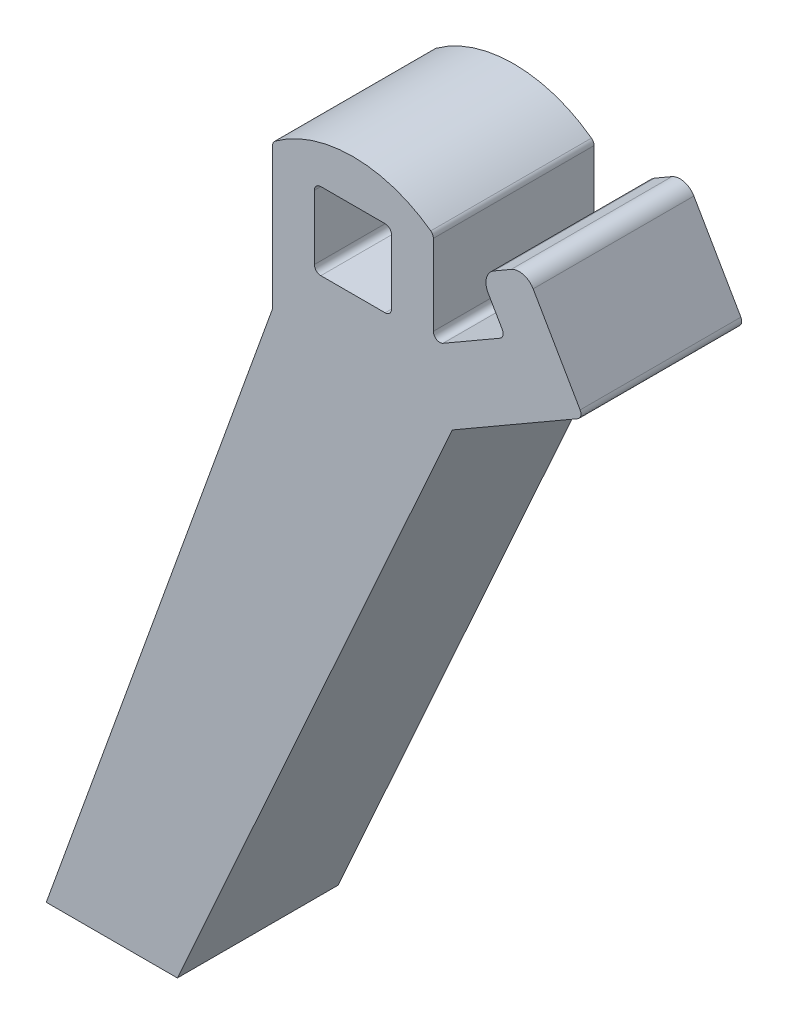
SolidWorks part; units mm, degrees
ref_plane "Front Plane" through (0, 0, 0) normal (0, 0, 1) x (1, 0, 0)
ref_plane "Top Plane" through (0, 0, 0) normal (0, 1, 0) x (1, 0, 0)
ref_plane "Right Plane" through (0, 0, 0) normal (1, 0, 0) x (0, 0, -1)
sketch "Sketch1" plane through (0, 0, 0) normal (0, 0, 1) x (1, 0, 0)
  line L0 (0, 0) -> (5.1793, 0)
  line L1 (15.2914, 26.7408) -> (18.1406, 28.3859)
  line L2 (17.1359, 30.126) -> (18.1406, 28.3859)
  line L3 (0, 0) -> (8.9414, 24.7827)
  line L4 (16.0397, 24.1807) -> (21.2166, 27.1697)
  line L6 (8.9414, 24.7827) -> (8.9414, 30.4865)
  line L7 (10.5924, 29.9099) -> (13.6404, 29.9099)
  line L8 (15.2914, 26.7408) -> (15.2914, 30.4865)
  line L9 (5.1793, 0) -> (16.0397, 24.1807)
  line L10 (21.2166, 27.1697) -> (18.9163, 31.1539)
  line L11 (18.9163, 31.1539) -> (17.1359, 30.126)
  line L12 (10.5924, 29.9099) -> (10.5924, 26.8619)
  line L13 (10.5924, 26.8619) -> (13.6404, 26.8619)
  line L14 (13.6404, 29.9099) -> (13.6404, 26.8619)
  line L15 (10.5924, 29.9099) -> (13.6404, 26.8619) construction
  line L16 (10.5924, 26.8619) -> (13.6404, 29.9099) construction
  arc A2 (15.2914, 30.4865) -> (8.9414, 30.4865) centre (12.1164, 26.3831) ccw
  point P4 (12.1164, 28.3859)
extrude "Boss-Extrude1" add sketch "Sketch1" along normal blind 6.35
fillet "Fillet2" radius 0.254 2 edges at (15.2914, 30.4865, 3.175) (8.9414, 30.4865, 3.175)
fillet "Fillet3" radius 0.254 3 edges at (15.2914, 26.7408, 3.175) (21.2166, 27.1697, 3.175) (18.1406, 28.3859, 3.175)
fillet "Fillet4" radius 0.635 2 edges at (18.9163, 31.1539, 3.175) (17.1359, 30.126, 3.175)
fillet "Fillet5" radius 0.254 4 edges at (13.6404, 26.8619, 3.175) (10.5924, 26.8619, 3.175) (13.6404, 29.9099, 3.175) (10.5924, 29.9099, 3.175)
